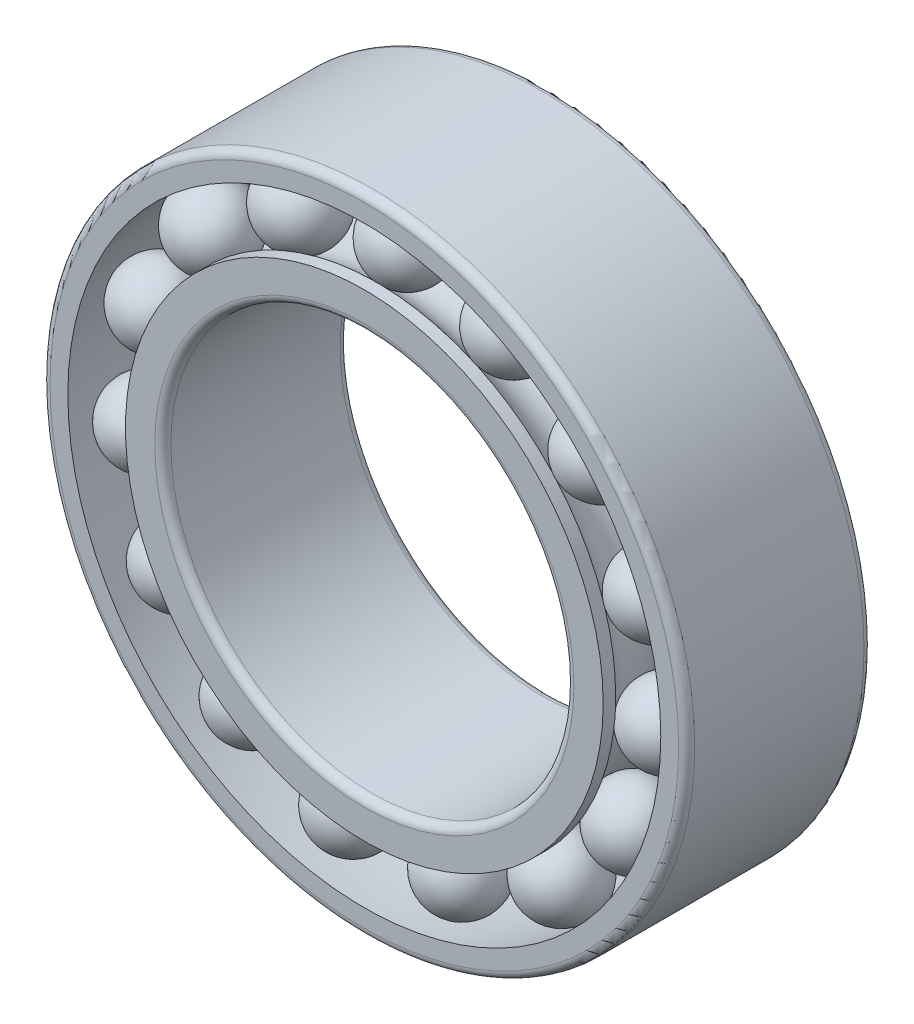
SolidWorks part; units mm, degrees
ref_plane "Front Plane" through (0, 0, 0) normal (0, 0, 1) x (1, 0, 0)
ref_plane "Top Plane" through (0, 0, 0) normal (0, 1, 0) x (1, 0, 0)
ref_plane "Right Plane" through (0, 0, 0) normal (1, 0, 0) x (0, 0, -1)
sketch "BaseSke" plane through (0, 0, 0) normal (1, 0, 0) x (0, 0, -1)
  line L0 (-47.2296, 0) -> (24.6132, 0) construction
  line L1 (-47.2296, 32.5) -> (24.6132, 32.5) construction
  line L2 (0, 129.5214) -> (0, -86.3012) construction
  line L3 (-6.1333, 37.2917) -> (-6.1333, 27.7083)
  line L4 (-11.5, 40) -> (11.5, 40) construction
  line L5 (-11.5, 25) -> (11.5, 25) construction
  line L6 (-11.5, 40) -> (-11.5, 25) construction
  line L7 (11.5, 40) -> (11.5, 25) construction
  line L8 (-10.925, 40) -> (-10.925, 25) construction
  arc A0 (-6.1333, 37.2917) -> (-6.1333, 27.7083) centre (-6.1333, 32.5) ccw
  dimension "D2" = 0.575
  dimension "Ball_diameter" = 9.5833
  dimension "D1" = 32.5
  dimension "Bearing_Thickness" = 23
  dimension "Bearing_Outside_Diameter" = 80
  dimension "Bearing_Inside_Diameter" = 50
revolve "Ball" add sketch "BaseSke" angle 360 about L3
sketch "OuterRaceSke" plane through (0, 0, 0) normal (1, 0, 0) x (0, 0, -1)
  line L0 (0, 0) -> (0, 87.5396) construction
  line L1 (-11.5, 40) -> (11.5, 40)
  line L2 (-11.5, 40) -> (-11.5, 36.7859)
  line L4 (11.5, 40) -> (11.5, 36.7859)
  line L5 (-50.3916, 0) -> (55.2197, 0) construction
  arc A0 (-11.5, 36.7859) -> (11.5, 36.7859) centre (0, -62.5507) cw
  arc A1 (-11.5, 36.8262) -> (11.5, 36.8262) centre (0, -62.5507) cw construction
  arc A2 (-6.1333, 37.2917) -> (-6.1333, 27.7083) centre (-6.1333, 32.5) ccw construction
  dimension "D1" = 100
  dimension "D2" = 0.04
revolve "OuterRace" add sketch "OuterRaceSke" angle 360 about L5
mirror "MirrorBall" about plane through (0, 0, 0) normal (0, 0, 1) of "Ball"
sketch "InnerRaceSke" plane through (0, 0, 0) normal (1, 0, 0) x (0, 0, -1)
  line L0 (-70.8626, 0) -> (113.5527, 0) construction
  line L1 (0, 58.441) -> (0, -70.8113) construction
  line L2 (-11.5, 25) -> (11.5, 25)
  line L3 (-11.5, 25) -> (-11.5, 29.6379)
  line L4 (-11.5, 29.6379) -> (-9.9495, 29.6379)
  line L5 (11.5, 25) -> (11.5, 29.6379)
  line L6 (0, 129.5214) -> (0, -86.3012) construction
  line L7 (-2.3172, 29.6379) -> (2.3172, 29.6379)
  line L8 (11.5, 29.6379) -> (9.9495, 29.6379)
  line L9 (-47.2296, 32.5) -> (24.6132, 32.5) construction
  arc A0 (-9.9495, 29.6379) -> (-2.3172, 29.6379) centre (-6.1333, 32.5) ccw
  circle A1 centre (-6.1333, 32.5) radius 4.7917 construction
  arc A2 (9.9495, 29.6379) -> (2.3172, 29.6379) centre (6.1333, 32.5) cw
  point P17 (0, 25)
  point P23 (0, 29.6379)
  dimension "D2" = 9.5403
  dimension "D1" = 2.8621
revolve "InnerRace" add sketch "InnerRaceSke" angle 360 about L0
fillet "Fillet1" radius 1 4 edges at (25, 0, -11.5) (25, 0, 11.5) (40, 0, -11.5) (40, 0, 11.5)
pattern_circular "CirPatternBall" count 15 over 360 about axis through (0, 0, 0) along (0, 0, 1) of "Ball", "MirrorBall"
sketch "SimplifiedSke" plane through (0, 0, 0) normal (1, 0, 0) x (0, 0, -1)
  line L0 (37.5911, 0) -> (-37.5911, 0) construction
  line L1 (0, 0) -> (0, 72.9012) construction
  circle A0 centre (-6.1333, 32.5) radius 4.7917
  circle A1 centre (-6.1333, 32.5) radius 4.7917 construction
  circle A2 centre (6.1333, 32.5) radius 4.7917
revolve "Simplified" [suppressed] add sketch "SimplifiedSke" angle 360 about L0
equation "\"D1@BaseSke\" =  (\"Bearing_Outside_Diameter@BaseSke\"  +  \"Bearing_Inside_Diameter@BaseSke\"  )  / 4"
equation "\"Ball_diameter@BaseSke\" = \"Bearing_Thickness@BaseSke\" / 2.4"
equation "\"D2@BaseSke\" = \"Bearing_Thickness@BaseSke\"/40"
equation "\"D1@CirPatternBall\" = int( \"D1@BaseSke\"* pi  * 2 / \"Ball_diameter@BaseSke\" /1.4)"
equation "\"D2@InnerRaceSke\" = \"Ball_diameter@BaseSke\"-0.02-0.001*\"Bearing_Thickness@BaseSke\""
equation "\"D1@OuterRaceSke\" = \"Bearing_Inside_Diameter@BaseSke\"*2"
equation "\"D1@InnerRaceSke\" = \"D2@InnerRaceSke\" * 0.3"
